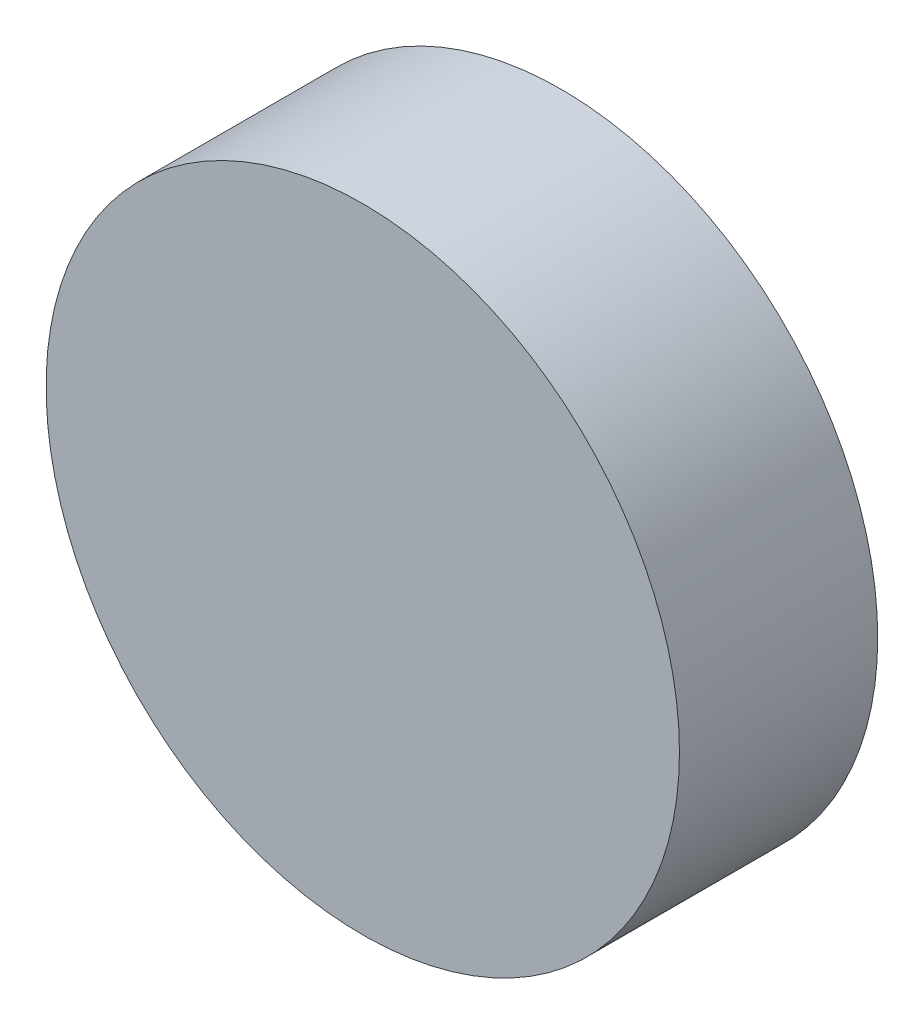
SolidWorks part; units mm, degrees
ref_plane "Front Plane" through (0, 0, 0) normal (0, 0, 1) x (1, 0, 0)
ref_plane "Top Plane" through (0, 0, 0) normal (0, 1, 0) x (1, 0, 0)
ref_plane "Right Plane" through (0, 0, 0) normal (1, 0, 0) x (0, 0, -1)
sketch "Sketch1" plane through (0, 0, 0) normal (0, 0, 1) x (1, 0, 0)
  circle A0 centre (0, 0) radius 73.025
  dimension "D1" = 146.05
extrude "Boss-Extrude1" add sketch "Sketch1" along normal blind 45.72
sketch "Sketch2" plane through (0, 0, 0) normal (0, 0, -1) x (-1, 0, 0)
  circle A0 centre (0, 0) radius 60.325
  circle A1 centre (0, 0) radius 68.834
  dimension "D1" = 137.668
  dimension "D2" = 120.65
sketch "Sketch3" plane through (0, 0, 0) normal (0, 0, 1) x (1, 0, 0)
  line L1 (0, 0) -> (121.6571, 0)
  line L2 (0, 0) -> (0, -123.8754)
  line L3 (0, -123.8754) -> (121.6571, -123.8754)
  line L4 (121.6571, 0) -> (121.6571, -123.8754)
extrude "FEA" [suppressed] cut sketch "Sketch3" along normal through all flip side to cut
equation "\"Air Weight\"= \"SW-Mass\""
equation "\"Buoyancy\"= \"SW-Volume\" * ( \"SW-Density\" - .037062 )"
